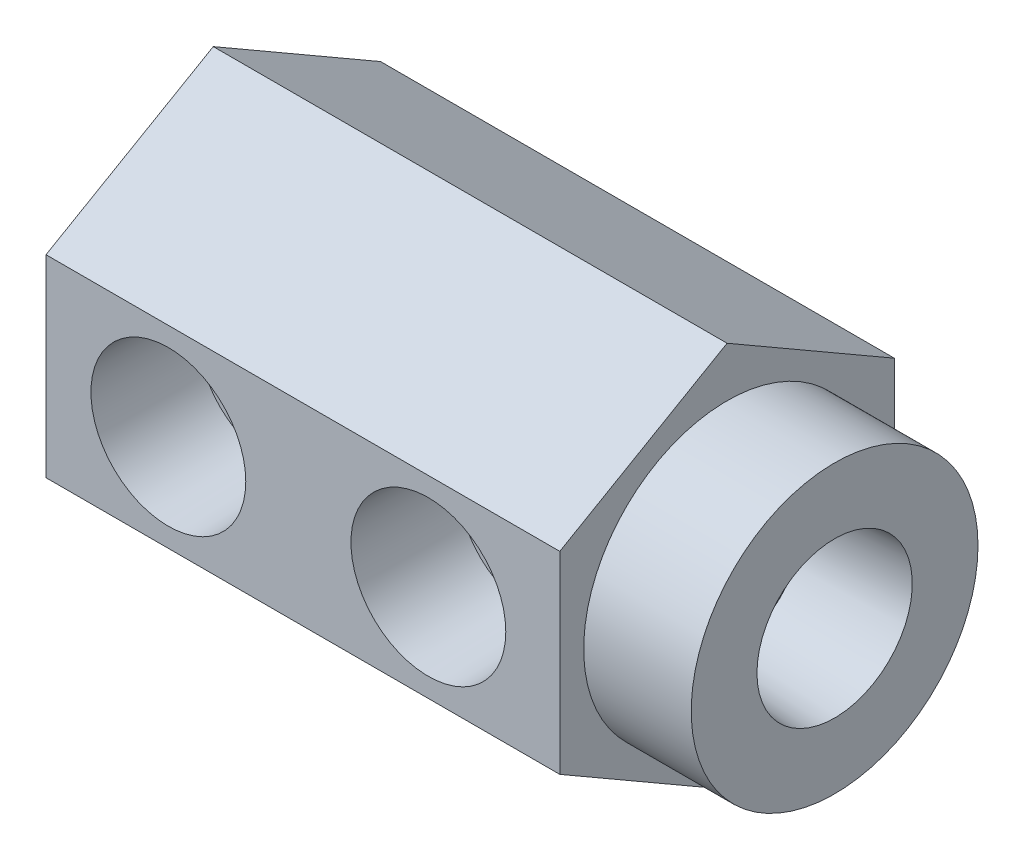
SolidWorks part; units mm, degrees
ref_plane "Front Plane" through (0, 0, 0) normal (0, 0, 1) x (1, 0, 0)
ref_plane "Top Plane" through (0, 0, 0) normal (0, 1, 0) x (1, 0, 0)
ref_plane "Right Plane" through (0, 0, 0) normal (1, 0, 0) x (0, 0, -1)
sketch "Sketch1" plane through (0, 0, 0) normal (1, 0, 0) x (0, 0, -1)
  line L0 (0, 14.1148) -> (0, -14.1148) construction
  line L1 (-11.1125, 6.4158) -> (-11.1125, -6.4158)
  line L2 (-11.1125, -6.4158) -> (0, -12.8316)
  line L3 (0, -12.8316) -> (11.1125, -6.4158)
  line L4 (11.1125, -6.4158) -> (11.1125, 6.4158)
  line L5 (11.1125, 6.4158) -> (0, 12.8316)
  line L6 (0, 12.8316) -> (-11.1125, 6.4158)
  circle A0 centre (0, 0) radius 11.1125 construction
  dimension "D1" = 22.225
extrude "Boss-Extrude1" add sketch "Sketch1" along normal blind 34.1313 separate body
sketch "Sketch2" plane through (0, 0, 0) normal (1, 0, 0) x (0, 0, -1)
  circle A1 centre (0, 0) radius 9.525
  dimension "D1" = 19.05
extrude "Boss-Extrude2" add sketch "Sketch2" along normal blind 41.275
sketch "Sketch4" plane through (0, 0, 0) normal (0, 1, 0) x (1, 0, 0)
  line L0 (25.4, 0) -> (25.4, 4.3688)
  line L4 (41.275, 5.1589) -> (34.29, 4.7928)
  line L5 (34.29, 4.3688) -> (34.29, 4.7928)
  line L6 (34.29, 4.3688) -> (25.4, 4.3688)
  line L7 (41.275, -9.525) -> (41.275, 9.525) construction
  line L8 (41.275, 0) -> (41.275, 5.1589)
  line L9 (-4.0119, 0) -> (49995.9881, 0) construction
  line L10 (41.275, 0) -> (25.4, 0)
  dimension "D1" = 8.7376
  dimension "D2" = 6.985
  dimension "D3" = 3
  dimension "D4" = 10.3177
  dimension "D5" = 15.875
revolve "Cut-Revolve1" cut sketch "Sketch4" angle 360 about L9
hole_wizard "1/8 NPT Tapped Hole1" positions "Sketch6" profile "Sketch5" size "1/8" standard "Ansi Inch"
sketch "Sketch6" plane through (-12.6821, 7.3478, -11.1125) normal (0, 0, -1) x (-1, 0, 0)
  line L0 (-12.6821, 4.876) -> (-12.6821, -19.5715) construction
  line L1 (-0.4584, -7.3478) -> (-24.9059, -7.3478) construction
  point P0 (-20.8101, -7.3478)
  dimension "D1" = 8.128
sketch "Sketch5" plane through (8.128, 0, -11.1125) normal (1, 0, 0) x (0, 1, 0)
  line L0 (0, 0) -> (0, 18.4085)
  line L1 (4.2164, 15.875) -> (0, 18.4085)
  line L2 (-4.2164, 15.875) -> (0, 18.4085) construction
  line L3 (4.2164, 15.875) -> (4.2164, 6.924)
  line L4 (4.2164, 6.924) -> (5.1091, 6.924)
  line L5 (5.1091, 6.924) -> (5.3164, 0)
  line L6 (-5.1091, 6.924) -> (-5.3164, 0) construction
  line L7 (5.3164, 0) -> (0, 0)
  line L8 (0, -6.35) -> (0, 107.95) construction
  line L11 (-4.2164, 6.924) -> (-5.1091, 6.924) construction
  dimension "Tap Drill Dia." = 8.4328
  dimension "Tap Drill Depth" = 15.875
  dimension "Thread Dia." = 10.6329
  dimension "Thread Angle" = 3.43
  dimension "Thread Depth" = 6.924
  dimension "Drill Angle" = 118
hole_wizard "1/8 NPT Tapped Hole2" positions "Sketch8" profile "Sketch7" size "1/8" standard "Ansi Inch"
sketch "Sketch8" plane through (0, 0, 11.1125) normal (0, 0, 1) x (1, 0, 0)
  line L0 (0, -12.2238) -> (0, 12.2238) construction
  circle A0 centre (8.128, 0) radius 5.3164 construction
  point P0 (8.128, 0)
  point P1 (25.4, 0)
  dimension "D1" = 25.4
sketch "Sketch7" plane through (8.128, 0, 11.1125) normal (1, 0, 0) x (0, -1, 0)
  line L0 (0, 0) -> (0, 18.4085)
  line L1 (4.2164, 15.875) -> (0, 18.4085)
  line L2 (-4.2164, 15.875) -> (0, 18.4085) construction
  line L3 (4.2164, 15.875) -> (4.2164, 6.924)
  line L4 (4.2164, 6.924) -> (4.9362, 6.924)
  line L5 (4.9362, 6.924) -> (5.1435, 0)
  line L6 (-4.9362, 6.924) -> (-5.1435, 0) construction
  line L7 (5.1435, 0) -> (0, 0)
  line L8 (0, -6.35) -> (0, 107.95) construction
  line L11 (-4.2164, 6.924) -> (-4.9362, 6.924) construction
  dimension "Tap Drill Dia." = 8.4328
  dimension "Tap Drill Depth" = 15.875
  dimension "Thread Dia." = 10.287
  dimension "Thread Angle" = 3.43
  dimension "Thread Depth" = 6.924
  dimension "Drill Angle" = 118
hole_wizard "#21 (0.159) Diameter Hole1" positions "Sketch10" profile "Sketch9" hole size "#21" standard "Ansi Inch"
sketch "Sketch10" plane through (41.275, 0, 0) normal (1, 0, 0) x (0, 0, -1)
  circle A0 centre (0, 0) radius 9.525 construction
  point P0 (0, 0)
sketch "Sketch9" plane through (41.275, 0, 0) normal (0, 1, 0) x (0, 0, -1)
  line L0 (0, 0) -> (0, 32.9633)
  line L1 (0, 32.9633) -> (2.0193, 31.75)
  line L2 (2.0193, 31.75) -> (2.0193, 0)
  line L5 (2.0193, 0) -> (0, 0)
  line L10 (0, 32.9633) -> (-2.0193, 31.75) construction
  line L11 (0, -6.35) -> (0, 107.95) construction
  dimension "Hole Dia." = 4.0386
  dimension "Hole Depth" = 31.75
  dimension "Drill Angle" = 118
hole_wizard "3/16 (0.1875) Diameter Hole1" positions "Sketch12" profile "Sketch11" hole size "3/16" standard "Ansi Inch"
sketch "Sketch12" plane through (41.275, 0, 0) normal (1, 0, 0) x (0, 0, -1)
  circle A0 centre (0, 0) radius 9.525 construction
  point P0 (0, 0)
sketch "Sketch11" plane through (41.275, 0, 0) normal (0, 1, 0) x (0, 0, -1)
  line L0 (0, 0) -> (0, 23.6558)
  line L1 (0, 23.6558) -> (2.3812, 22.225)
  line L2 (2.3812, 22.225) -> (2.3812, 0)
  line L5 (2.3812, 0) -> (0, 0)
  line L10 (0, 23.6558) -> (-2.3813, 22.225) construction
  line L11 (0, -6.35) -> (0, 107.95) construction
  dimension "Hole Dia." = 4.7625
  dimension "Hole Depth" = 22.225
  dimension "Drill Angle" = 118
